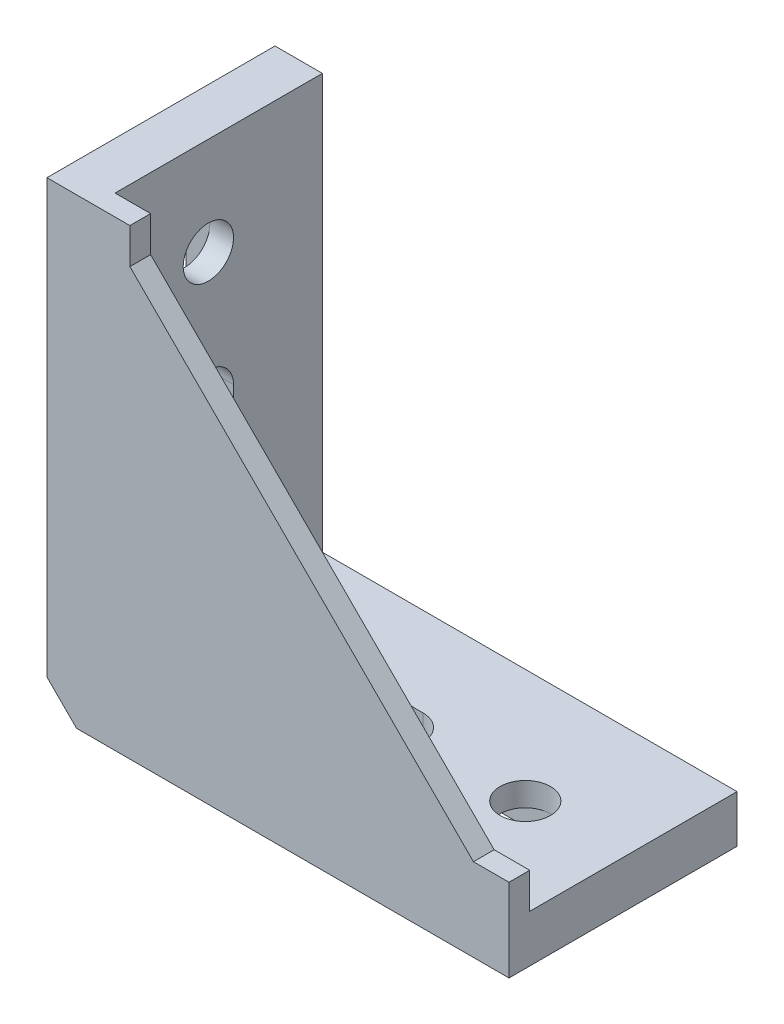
SolidWorks part; units mm, degrees
ref_plane "前视基准面" through (0, 0, 0) normal (0, 0, 1) x (1, 0, 0)
ref_plane "上视基准面" through (0, 0, 0) normal (0, 1, 0) x (1, 0, 0)
ref_plane "右视基准面" through (0, 0, 0) normal (1, 0, 0) x (0, 0, -1)
sketch "草图1" plane through (0, 0, 0) normal (0, 0, 1) x (1, 0, 0)
  line L0 (-40.5064, 37.2388) -> (-32.5064, 37.2388)
  line L1 (-32.5064, 37.2388) -> (-32.5064, -32.7612)
  line L2 (-32.5064, -32.7612) -> (37.4936, -32.7612)
  line L3 (37.4936, -32.7612) -> (37.4936, -40.7612)
  line L4 (37.4936, -40.7612) -> (-40.5064, -40.7612)
  line L5 (-40.5064, -40.7612) -> (-40.5064, 37.2388)
  dimension "D1" = 8
  dimension "D2" = 8
  dimension "D3" = 78
  dimension "D4" = 78
extrude "凸台-拉伸1" add sketch "草图1" along normal blind 38.5
sketch "草图2" plane through (0, 0, 38.5) normal (0, 0, 1) x (1, 0, 0)
  line L0 (-32.5064, 37.2388) -> (-26.5064, 37.2388)
  line L1 (-26.5064, 37.2388) -> (-26.5064, 31.2388)
  line L2 (-26.5064, 31.2388) -> (31.4936, -26.7612)
  line L3 (31.4936, -26.7612) -> (37.4936, -26.7612)
  line L4 (37.4936, -26.7612) -> (37.4936, -32.7612)
  line L5 (37.4936, -32.7612) -> (-32.5064, -32.7612)
  line L6 (37.4936, -32.7612) -> (-32.5064, -32.7612) construction
  line L7 (-32.5064, -32.7612) -> (-32.5064, 37.2388) construction
  line L8 (-32.5064, -32.7612) -> (-32.5064, 37.2388)
  dimension "D1" = 6
  dimension "D2" = 6
  dimension "D3" = 6
  dimension "D4" = 6
extrude "凸台-拉伸2" add sketch "草图2" against normal blind 3.5
sketch "草图3" plane through (-40.5064, 0, 0) normal (-1, 0, 0) x (0, 0, 1)
  line L0 (19.25, 37.2388) -> (19.25, -40.7612)
  line L1 (38.5, 37.2388) -> (0, 37.2388) construction
  line L2 (38.5, -40.7612) -> (0, -40.7612) construction
  line L3 (19.25, -0.7612) -> (19.25, -18.7612) construction
  line L4 (23.5, -0.7612) -> (23.5, -18.7612)
  line L5 (15, -0.7612) -> (15, -18.7612)
  circle A0 centre (19.25, 20.7388) radius 4.25
  arc A1 (23.5, -0.7612) -> (15, -0.7612) centre (19.25, -0.7612) ccw
  arc A2 (15, -18.7612) -> (23.5, -18.7612) centre (19.25, -18.7612) ccw
  point P10 (19.25, -9.7612)
  dimension "D1" = 8.5
  dimension "D2" = 8.5
  dimension "D3" = 16.5
  dimension "D4" = 22
  dimension "D5" = 18
extrude "切除-拉伸1" cut sketch "草图3" against normal through all contours L5 A2 L0 A1 | L0 A2 L4 A1 | A0
sketch "草图4" plane through (-40.5064, 0, 0) normal (-1, 0, 0) x (0, 0, 1)
  line L0 (3, 33.7388) -> (11.5, 33.7388)
  line L1 (11.5, 33.7388) -> (11.5, -32.7612)
  line L2 (11.5, -32.7612) -> (3, -32.7612)
  line L3 (3, -32.7612) -> (3, 33.7388)
  line L4 (26.5, 33.7388) -> (35, 33.7388)
  line L5 (35, 33.7388) -> (35, -32.7612)
  line L6 (35, -32.7612) -> (26.5, -32.7612)
  line L7 (26.5, -32.7612) -> (26.5, 33.7388)
  line L8 (38.5, 37.2388) -> (38.5, -40.7612) construction
  line L9 (15, 30.2388) -> (23.5, 30.2388)
  line L10 (15, 30.2388) -> (15, -29.7612)
  line L11 (15, -29.7612) -> (23.5, -29.7612)
  line L12 (23.5, -29.7612) -> (23.5, 30.2388)
  line L13 (38.5, 37.2388) -> (0, 37.2388) construction
  line L14 (38.5, -40.7612) -> (0, -40.7612) construction
  line L15 (0, 37.2388) -> (0, -40.7612) construction
  dimension "D1" = 3.5
  dimension "D2" = 8.5
  dimension "D3" = 8.5
  dimension "D4" = 3.5
  dimension "D5" = 3.5
  dimension "D6" = 8
  dimension "D7" = 11
  dimension "D8" = 7
  dimension "D9" = 3
extrude "切除-拉伸2" cut sketch "草图4" against normal blind 4
sketch "草图5" plane through (-40.5064, 0, 0) normal (-1, 0, 0) x (0, 0, 1)
  line L0 (15.35, 30.2388) -> (15.35, 33.2513)
  line L1 (23.5, 30.2388) -> (15, 30.2388) construction
  line L2 (15.35, 33.2513) -> (23.15, 33.2513)
  line L3 (23.15, 33.2513) -> (23.15, 30.2388)
  line L4 (23.15, 30.2388) -> (15.35, 30.2388)
  line L5 (15.35, -29.7612) -> (15.35, -32.9792)
  line L6 (15, -29.7612) -> (23.5, -29.7612) construction
  line L7 (15.35, -32.9792) -> (23.15, -32.9792)
  line L8 (23.15, -32.9792) -> (23.15, -29.7612)
  line L9 (23.15, -29.7612) -> (15.35, -29.7612)
  line L10 (0, 37.2388) -> (0, -40.7612) construction
  point P14 (21.4227, -33.9779)
  dimension "D1" = 7.8
  dimension "D2" = 15.35
  dimension "D3" = 7.8
  dimension "D4" = 15.35
extrude "凸台-拉伸3" add sketch "草图5" along normal blind 2
ref_plane "基准面1" through (0.1274, -0.1274, 0) normal (0.7071, -0.7071, 0) x (0.7071, 0.7071, 0)
mirror "镜向1" about plane through (0.1274, -0.1274, 0) normal (0.7071, -0.7071, 0) of "切除-拉伸2"
mirror "镜向2" about plane through (0.1274, -0.1274, 0) normal (0.7071, -0.7071, 0) of "切除-拉伸1", "镜向1"
mirror "镜向3" about plane through (0.1274, -0.1274, 0) normal (0.7071, -0.7071, 0) of "凸台-拉伸3", "镜向2"
chamfer "倒角1" distance 5 angle 45 1 edges at (-40.5064, -40.7612, 19.25)
